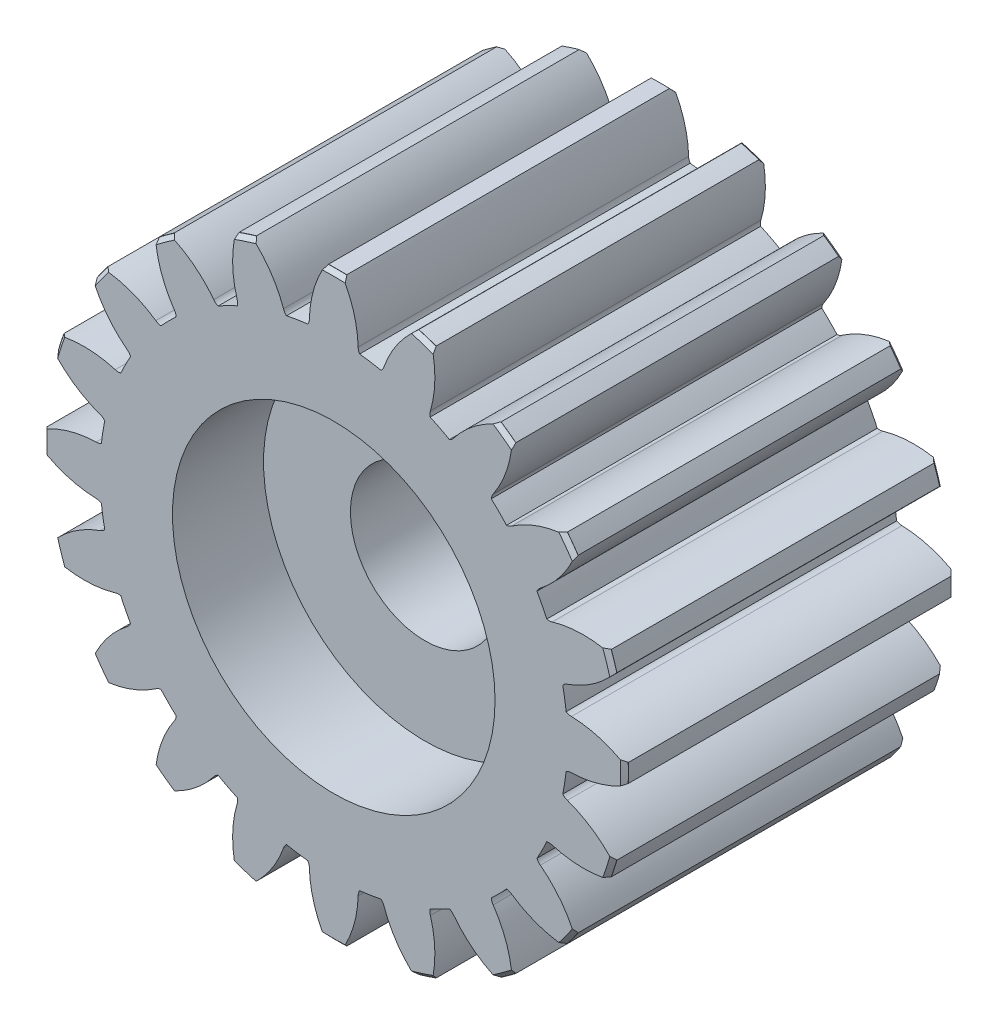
SolidWorks part; units mm, degrees
ref_plane "Front Plane" through (0, 0, 0) normal (0, 0, 1) x (1, 0, 0)
ref_plane "Top Plane" through (0, 0, 0) normal (0, 1, 0) x (1, 0, 0)
ref_plane "Right Plane" through (0, 0, 0) normal (1, 0, 0) x (0, 0, -1)
sketch "Sketch1" plane through (0, 0, 0) normal (0, 0, 1) x (1, 0, 0)
  circle A0 centre (0, 0) radius 44.92
  circle A1 centre (0, 0) radius 14.3
  dimension "D1" = 89.84
  dimension "D2" = 28.6
extrude "Boss-Extrude1" add sketch "Sketch1" against normal blind 63.5
sketch "Sketch2" plane through (0, 0, 0) normal (0, 0, 1) x (1, 0, 0)
  line L0 (0, 0) -> (0, 61.5891) construction
  arc A0 (1.75, 55.8526) -> (-1.75, 55.8526) centre (0, 0) ccw
  arc A1 (1.75, 55.8526) -> (4.6865, 45.665) centre (-16.535, 45.065) cw
  arc A2 (4.6865, 45.665) -> (4.9666, 44.6446) centre (6.6865, 45.6653) ccw
  arc A3 (-4.6865, 45.665) -> (-4.9666, 44.6446) centre (-6.6865, 45.6653) cw
  circle A5 centre (0, 0) radius 44.92
  arc A6 (4.9666, 44.6446) -> (-4.9666, 44.6446) centre (0, 0) ccw
  arc A7 (-1.75, 55.8526) -> (-4.6865, 45.665) centre (16.535, 45.065) ccw
  dimension "D1" = 111.76
  dimension "D2" = 21.23
  dimension "D4" = 0
  dimension "D6" = 2
  dimension "D3" = 1.75
  dimension "D5" = 16.535
  dimension "D7" = 6.6865
  dimension "D8" = 45.6653
extrude "Boss-Extrude2" add sketch "Sketch2" against normal blind 63.5
pattern_circular "CirPattern1" count 20 over 360 about axis through (0, 0, 0) along (0, 0, 1) of "Boss-Extrude2"
sketch "Sketch4" plane through (0, 0, 0) normal (0, 1, 0) x (1, 0, 0)
  line L0 (55.8516, 0.75) -> (55.1016, 0)
  line L1 (55.1016, 0) -> (56.2826, 0)
  line L2 (45.665, 0) -> (55.8526, 0) construction
  line L3 (55.8516, 0.75) -> (56.2826, 0.75)
  line L4 (0, 63.5) -> (0, 0) construction
  line L7 (56.2826, 0.75) -> (56.2826, 0)
  line L8 (55.8526, 63.5) -> (55.8526, 0) construction
  dimension "D1" = 45
  dimension "D2" = 0.43
  dimension "D3" = 0.75
  dimension "D4" = 55.1016
revolve "Cut-Revolve1" cut sketch "Sketch4" angle 360 about axis through (0, 0, -63.5) along (0, 0, 1)
ref_plane "Plane1" through (0, 0, -31.75) normal (0, 0, 1) x (1, 0, 0)
mirror "Mirror1" about plane through (0, 0, -31.75) normal (0, 0, 1) of "Cut-Revolve1"
sketch "Sketch5" plane through (0, 0, 0) normal (0, 1, 0) x (1, 0, 0)
  line L0 (0, -10.39) -> (0, 74.3261) construction
  line L1 (0, 46) -> (30.99, 46)
  line L2 (30.99, 46) -> (30.99, 71)
  line L3 (30.99, 71) -> (0, 71)
  line L4 (0, 71) -> (0, 46)
  dimension "D1" = 30.99
  dimension "D2" = 17.5
  dimension "D3" = 25
revolve "Cut-Revolve2" cut sketch "Sketch5" angle 360 about L0
mirror "Mirror2" about plane through (0, 0, -31.75) normal (0, 0, 1) of "Cut-Revolve2"
